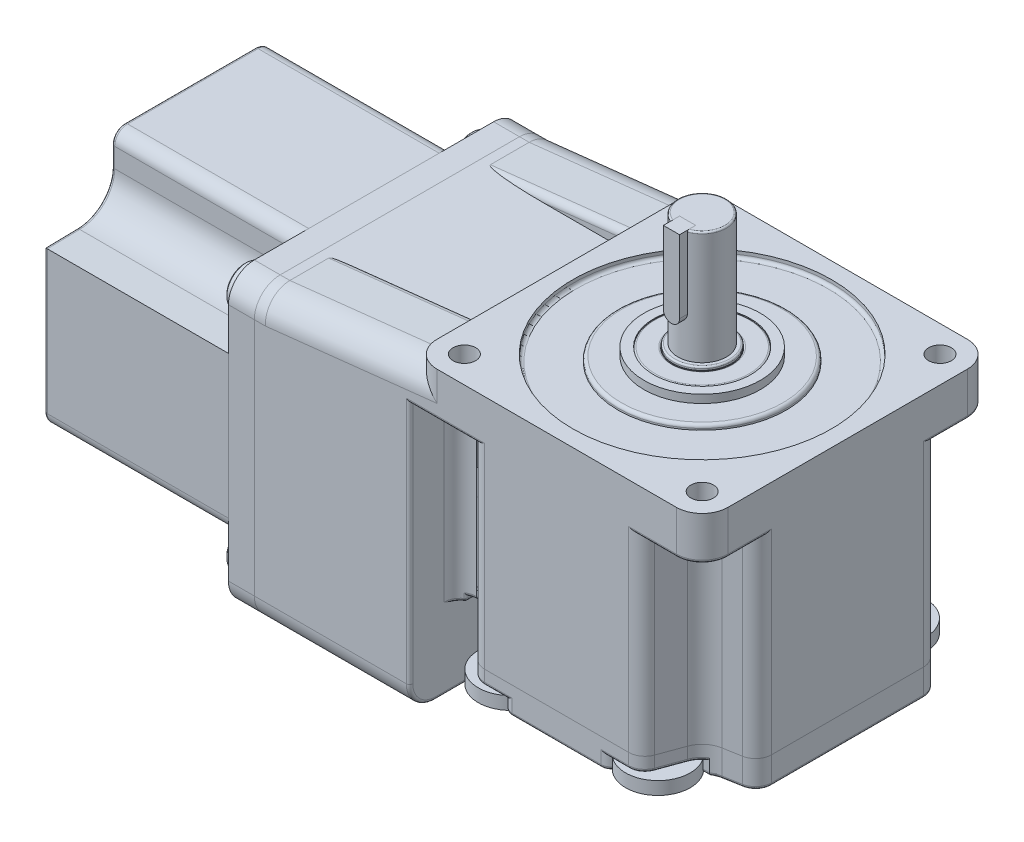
SolidWorks part; units mm, degrees
ref_plane "前视基准面" through (0, 0, 0) normal (0, 0, 1) x (1, 0, 0)
ref_plane "上视基准面" through (0, 0, 0) normal (0, 1, 0) x (1, 0, 0)
ref_plane "右视基准面" through (0, 0, 0) normal (1, 0, 0) x (0, 0, -1)
imported_body "90中实箱体-1-surface1"
imported_body "18X30X7-1-surface1"
imported_body "实心出轴后盖-1-surface1"
imported_body "Cross recessed pan head screws GB-18-surface1"
imported_body "Cross recessed pan head screws GB-19-surface1"
imported_body "Cross recessed pan head screws GB-20-surface1"
imported_body "Cross recessed pan head screws GB-21-surface1"
imported_body "90中实普通-1-surface1"
sketch "草图5" plane through (-83.3062, 0, 0) normal (-1, 0, 0) x (0, 0, 1)
  line L0 (-35, 11.8839) -> (-41, 11.8839)
  line L1 (-20.1716, -57.0915) -> (20.1716, -57.0915)
  line L2 (45, 11.8839) -> (45, -32.2631)
  line L7 (-45, 24.9085) -> (-45, -49.0915) construction
  line L8 (-45, 7.8839) -> (-45, -32.2631)
  line L9 (-41, -36.2631) -> (-35, -36.2631)
  line L11 (-24.1716, -47.0915) -> (-24.1716, -53.0915)
  line L12 (-37, -57.0915) -> (37, -57.0915) construction
  line L14 (24.1716, -47.0915) -> (24.1716, -53.0915)
  line L16 (35, -36.2631) -> (41, -36.2631)
  line L17 (45, -49.0915) -> (45, 24.9085) construction
  line L19 (45, 11.8839) -> (35, 12.0801)
  line L21 (24.1716, 22.9085) -> (24.1716, 28.9085)
  line L22 (37, 32.9085) -> (-37, 32.9085) construction
  line L23 (20.1716, 32.9085) -> (-20.1716, 32.9085)
  line L24 (-24.1716, 28.9085) -> (-24.1716, 22.9085)
  line L25 (-35, 11.8839) -> (-35, 12.0801)
  arc A0 (-35, 12.0801) -> (-24.1716, 22.9085) centre (-35, 22.9085) ccw
  arc A1 (24.1716, 22.9085) -> (35, 12.0801) centre (35, 22.9085) ccw
  arc A2 (35, -36.2631) -> (24.1716, -47.0915) centre (35, -47.0915) ccw
  arc A3 (-24.1716, -47.0915) -> (-35, -36.2631) centre (-35, -47.0915) ccw
  arc A4 (-41, 11.8839) -> (-45, 7.8839) centre (-41, 7.8839) ccw
  arc A5 (-45, -32.2631) -> (-41, -36.2631) centre (-41, -32.2631) ccw
  arc A6 (24.1716, -53.0915) -> (20.1716, -57.0915) centre (20.1716, -53.0915) cw
  arc A7 (-24.1716, -53.0915) -> (-20.1716, -57.0915) centre (-20.1716, -53.0915) ccw
  arc A8 (41, -36.2631) -> (45, -32.2631) centre (41, -32.2631) ccw
  arc A9 (24.1716, 28.9085) -> (20.1716, 32.9085) centre (20.1716, 28.9085) ccw
  arc A10 (-20.1716, 32.9085) -> (-24.1716, 28.9085) centre (-20.1716, 28.9085) ccw
  point P0 (0, -12.0915)
  point P7 (-45, 11.8839)
  point P35 (-45, -36.2631)
  point P38 (24.1716, -57.0915)
  point P41 (-24.1716, -57.0915)
  point P44 (45, -36.2631)
  point P47 (24.1716, 32.9085)
  point P50 (-24.1716, 32.9085)
  dimension "D1" = 4
extrude "凸台-拉伸2" add sketch "草图5" along normal blind 57
fillet "圆角1" radius 1 24 edges at (-140.3062, 11.8839, -38) (-140.3062, 11.982, -35) (-140.3062, 15.2516, -27.3431) (-140.3062, 25.9085, -24.1716) (-140.3062, 31.7369, -23) (-140.3062, 32.9085, 0) (-140.3062, 31.7369, 23) (-140.3062, 25.9085, 24.1716) (-140.3062, 15.2516, 27.3431) (-140.3062, 11.982, 40) (-140.3062, -10.1896, 45) (-140.3062, -35.0915, 43.8284) (-140.3062, -36.2631, 38) (-140.3062, -39.4347, 27.3431) (-140.3062, -50.0915, 24.1716) (-140.3062, -55.9199, 23) (-140.3062, -57.0915, 0) (-140.3062, -55.9199, -23) (-140.3062, -50.0915, -24.1716) (-140.3062, -39.4347, -27.3431) (-140.3062, -36.2631, -38) (-140.3062, -35.0915, -43.8284) (-140.3062, -12.1896, -45) (-140.3062, 10.7124, -43.8284)
sketch "草图6" plane through (-83.3062, 0, 0) normal (-1, 0, 0) x (0, 0, 1)
  circle A0 centre (-35, 22.9085) radius 6
  circle A1 centre (35, 22.9085) radius 6
  circle A2 centre (35, -47.0915) radius 6
  circle A3 centre (-35, -47.0915) radius 6
extrude "凸台-拉伸3" add sketch "草图6" along normal blind 5 separate body
sketch "草图7" plane through (-88.3062, 0, 0) normal (-1, 0, 0) x (0, 0, 1)
  line L1 (-31.5359, 22.9085) -> (-33.2679, 25.9085)
  line L2 (-33.2679, 25.9085) -> (-36.7321, 25.9085)
  line L3 (-36.7321, 25.9085) -> (-38.4641, 22.9085)
  line L4 (-38.4641, 22.9085) -> (-36.7321, 19.9085)
  line L5 (-36.7321, 19.9085) -> (-33.2679, 19.9085)
  line L6 (-33.2679, 19.9085) -> (-31.5359, 22.9085)
  line L7 (38.4641, 22.9085) -> (36.7321, 25.9085)
  line L8 (36.7321, 25.9085) -> (33.2679, 25.9085)
  line L9 (33.2679, 25.9085) -> (31.5359, 22.9085)
  line L10 (31.5359, 22.9085) -> (33.2679, 19.9085)
  line L11 (33.2679, 19.9085) -> (36.7321, 19.9085)
  line L12 (36.7321, 19.9085) -> (38.4641, 22.9085)
  line L13 (38.4641, -47.0915) -> (36.7321, -44.0915)
  line L14 (36.7321, -44.0915) -> (33.2679, -44.0915)
  line L15 (33.2679, -44.0915) -> (31.5359, -47.0915)
  line L16 (31.5359, -47.0915) -> (33.2679, -50.0915)
  line L17 (33.2679, -50.0915) -> (36.7321, -50.0915)
  line L18 (36.7321, -50.0915) -> (38.4641, -47.0915)
  line L19 (-31.5359, -47.0915) -> (-33.2679, -44.0915)
  line L20 (-33.2679, -44.0915) -> (-36.7321, -44.0915)
  line L21 (-36.7321, -44.0915) -> (-38.4641, -47.0915)
  line L22 (-38.4641, -47.0915) -> (-36.7321, -50.0915)
  line L23 (-36.7321, -50.0915) -> (-33.2679, -50.0915)
  line L24 (-33.2679, -50.0915) -> (-31.5359, -47.0915)
  circle A0 centre (-35, 22.9085) radius 3 construction
  circle A1 centre (35, 22.9085) radius 3 construction
  circle A2 centre (35, -47.0915) radius 3 construction
  circle A3 centre (-35, -47.0915) radius 3 construction
extrude "切除-拉伸1" cut sketch "草图7" against normal blind 2
chamfer "倒角1" distance 0.5 angle 45 7 edges at (-88.3062, 22.9085, -29) (-88.3062, 24.4085, -32.4019) (-88.3062, 25.9085, -35) (-88.3062, 24.4085, -37.5981) (-88.3062, 21.4085, -37.5981) (-88.3062, 19.9085, -35) (-88.3062, 21.4085, -32.4019)
chamfer "倒角2" distance 0.5 angle 45 7 edges at (-88.3062, 22.9085, 41) (-88.3062, 24.4085, 37.5981) (-88.3062, 25.9085, 35) (-88.3062, 24.4085, 32.4019) (-88.3062, 21.4085, 32.4019) (-88.3062, 19.9085, 35) (-88.3062, 21.4085, 37.5981)
chamfer "倒角3" distance 0.5 angle 45 7 edges at (-88.3062, -47.0915, 41) (-88.3062, -45.5915, 37.5981) (-88.3062, -44.0915, 35) (-88.3062, -45.5915, 32.4019) (-88.3062, -48.5915, 32.4019) (-88.3062, -50.0915, 35) (-88.3062, -48.5915, 37.5981)
chamfer "倒角4" distance 0.5 angle 45 7 edges at (-88.3062, -47.0915, -29) (-88.3062, -45.5915, -32.4019) (-88.3062, -44.0915, -35) (-88.3062, -45.5915, -37.5981) (-88.3062, -48.5915, -37.5981) (-88.3062, -50.0915, -35) (-88.3062, -48.5915, -32.4019)
sketch "草图15" plane through (0, 41.9085, 0) normal (0, 1, 0) x (1, 0, 0)
  circle A0 centre (18.1938, 0) radius 9
extrude "凸台-拉伸4" add sketch "草图15" along normal blind 1 separate body
fillet "圆角2" radius 0.5 1 edges at (18.1938, 42.9085, 9)
sketch "草图16" plane through (0, 42.9085, 0) normal (0, 1, 0) x (1, 0, 0)
  circle A0 centre (18.1938, 0) radius 7.5
extrude "凸台-拉伸5" add sketch "草图16" along normal blind 35
ref_plane "基准面3" through (0, 0, 7.5) normal (0, 0, 1) x (1, 0, 0)
sketch "草图17" plane through (0, 0, 7.5) normal (0, 0, 1) x (1, 0, 0)
  line L1 (25.6938, 77.9085) -> (10.6938, 77.9085) construction
  line L2 (15.6938, 55.4085) -> (15.6938, 77.9085)
  line L3 (15.6938, 77.9085) -> (20.6938, 77.9085)
  line L4 (20.6938, 77.9085) -> (20.6938, 55.4085)
  arc A0 (15.6938, 55.4085) -> (20.6938, 55.4085) centre (18.1938, 55.4085) ccw
extrude "切除-拉伸2" cut sketch "草图17" against normal blind 3
sketch "草图18" plane through (0, 0, 4.5) normal (0, 0, 1) x (1, 0, 0)
  line L0 (15.6938, 55.4085) -> (15.6938, 77.9085)
  line L1 (15.6938, 77.9085) -> (20.6938, 77.9085)
  line L2 (20.6938, 77.9085) -> (20.6938, 55.4085)
  arc A0 (15.6938, 55.4085) -> (20.6938, 55.4085) centre (18.1938, 55.4085) ccw
extrude "凸台-拉伸6" add sketch "草图18" along normal blind 5 separate body
fillet "圆角3" radius 0.5 1 edges at (18.1938, 77.9085, -7.5)
